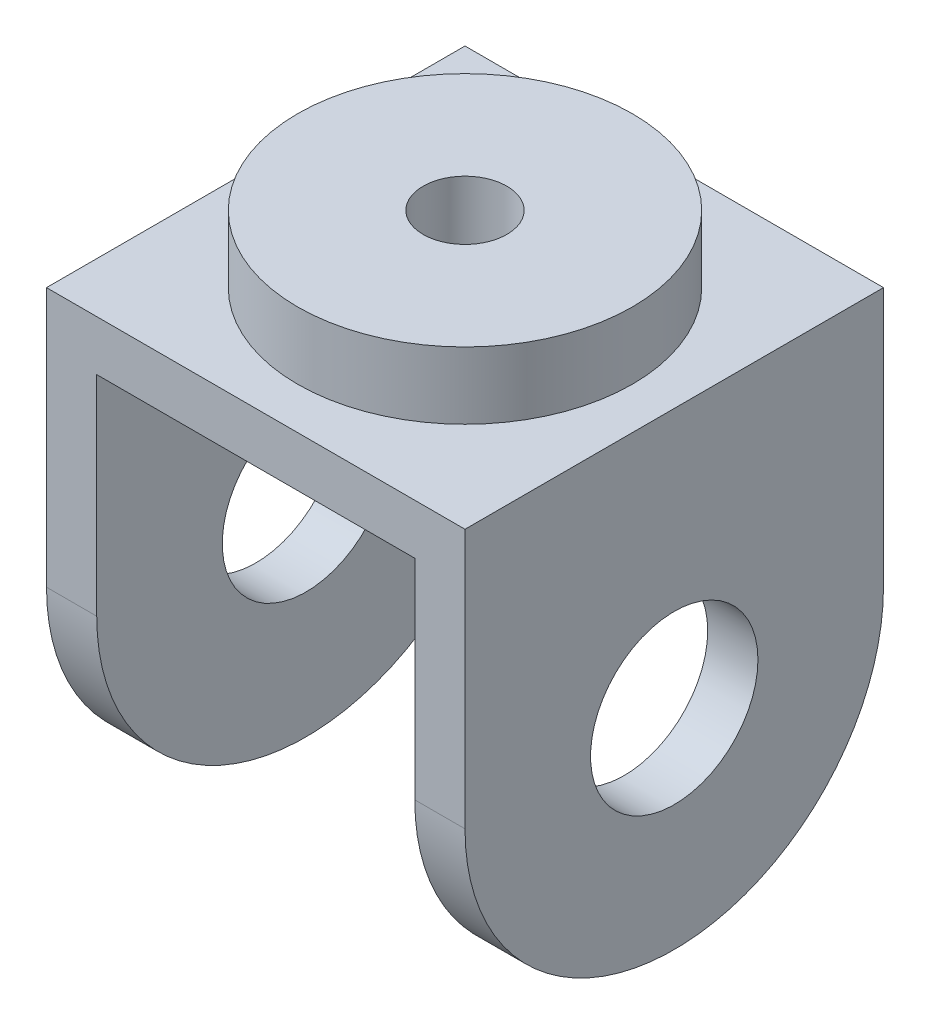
SolidWorks part; units mm, degrees
ref_plane "Front Plane" through (0, 0, 0) normal (0, 0, 1) x (1, 0, 0)
ref_plane "Top Plane" through (0, 0, 0) normal (0, 1, 0) x (1, 0, 0)
ref_plane "Right Plane" through (0, 0, 0) normal (1, 0, 0) x (0, 0, -1)
sketch "Sketch1" plane through (0, 0, 0) normal (1, 0, 0) x (0, 0, -1)
  line L0 (-41.9739, 0) -> (35.1158, 0) construction
  line L2 (-25, 0) -> (-25, 25)
  line L3 (-25, 25) -> (25, 25)
  line L4 (25, 0) -> (25, 25)
  circle A0 centre (0, 0) radius 10
  arc A1 (-25, 0) -> (25, 0) centre (0, 0) ccw
  point P0 (0, 0)
  dimension "D3" = 20
  dimension "D1" = 50
  dimension "D2" = 25
extrude "Boss-Extrude1" add sketch "Sketch1" along normal blind 6
ref_plane "Plane1" through (-19, 0, 0) normal (1, 0, 0) x (0, 0, -1)
sketch "Sketch2" plane through (0, 25, 0) normal (0, 1, 0) x (1, 0, 0)
  line L0 (6, 0) -> (-44, 0) construction
  line L1 (6, 25) -> (6, -25) construction
  line L2 (-19, 25) -> (-19, -18.7939) construction
  line L3 (-19, -27.5) -> (-19, 27.5) construction
  line L5 (-44, -25) -> (6, -25)
  line L6 (-44, -25) -> (-44, 25)
  line L7 (-44, 25) -> (6, 25)
  line L8 (6, -25) -> (6, 25)
  line L9 (-44, -25) -> (6, 25) construction
  line L10 (-44, 25) -> (6, -25) construction
  point P9 (-19, 0)
  dimension "D1" = 50
extrude "Boss-Extrude2" add sketch "Sketch2" along normal blind 6
mirror "Mirror1" about plane through (-19, 0, 0) normal (1, 0, 0) of "Boss-Extrude1"
sketch "Sketch3" plane through (0, 31, 0) normal (0, 1, 0) x (1, 0, 0)
  line L0 (-44, 25) -> (6, -25) construction
  line L1 (6, 25) -> (-44, -25) construction
  circle A0 centre (-19, 0) radius 20
  dimension "D1" = 40
extrude "Boss-Extrude3" add sketch "Sketch3" along normal blind 8
sketch "Sketch4" plane through (0, 39, 0) normal (0, 1, 0) x (1, 0, 0)
  circle A0 centre (-19, 0) radius 5
  dimension "D1" = 10
extrude "Cut-Extrude1" cut sketch "Sketch4" against normal through all
